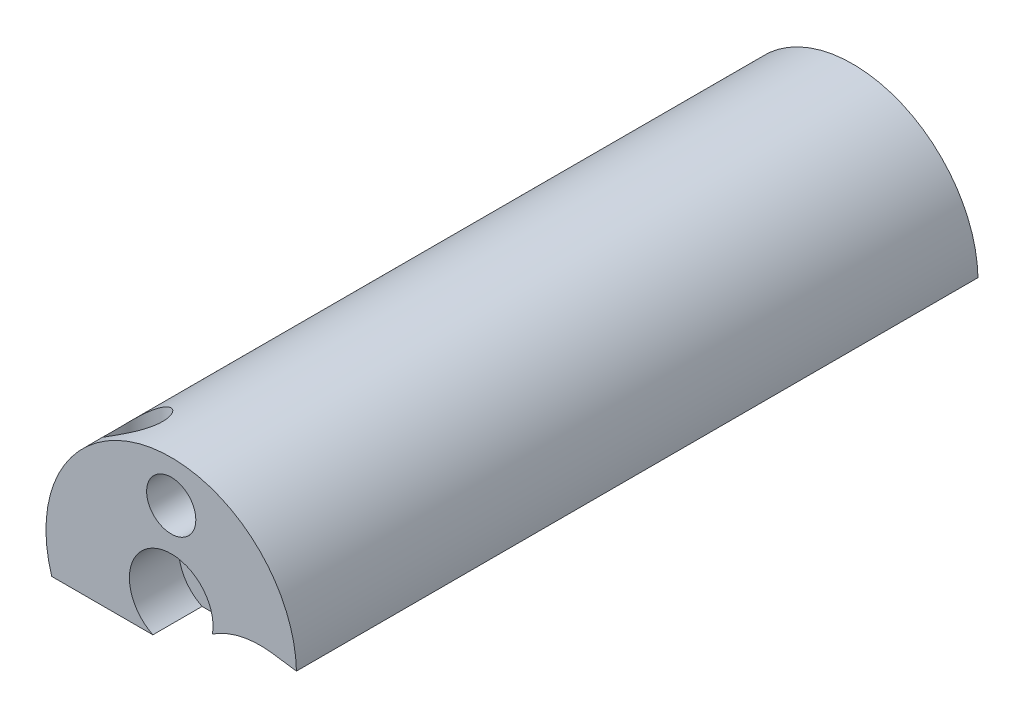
SolidWorks part; units mm, degrees
ref_plane "Face" through (0, 0, 0) normal (0, 0, 1) x (1, 0, 0)
ref_plane "Dessus" through (0, 0, 0) normal (0, 1, 0) x (1, 0, 0)
ref_plane "Droite" through (0, 0, 0) normal (1, 0, 0) x (0, 0, -1)
sketch "Esquisse1" plane through (0, 0, 0) normal (0, 0, 1) x (1, 0, 0)
  line L2 (-9.7467, -5.3471) -> (-4.9262, -5.3471)
  line L3 (-0.7787, -3.5686) -> (0.2024, -3.7065)
  line L4 (-9.7467, -5.3471) -> (-4.9262, -5.3471)
  line L5 (-0.7787, -3.5686) -> (0.2024, -3.7065)
  arc A3 (-4.9262, -5.3471) -> (-4.1148, -4.9442) centre (-4.9262, -4.3286) ccw
  arc A4 (-0.7787, -3.5686) -> (-4.1148, -4.9442) centre (-1.2748, -7.0987) ccw
  arc A5 (0.2024, -3.7065) -> (-9.7467, -5.3471) centre (-4.8888, -3.8194) ccw
  arc A6 (-4.9262, -5.3471) -> (-4.1148, -4.9442) centre (-4.9262, -4.3286) ccw
  arc A7 (-0.7787, -3.5686) -> (-4.1148, -4.9442) centre (-1.2748, -7.0987) ccw
  arc A8 (0.2024, -3.7065) -> (-9.7467, -5.3471) centre (-4.8888, -3.8194) ccw
  dimension "D1" = 0
extrude "Extrusion1" add sketch "Esquisse1" against normal up to surface (27.7093 mm away)
other "Empreinte1"
other "Elément Rabourdin 628-1,5-100 du centre<1>@jeu blocs empreintes droit_Etudiant_Corrigé"
sketch "Esquisse3" plane through (0, 0, 0) normal (0, 0, 1) x (1, 0, 0)
  circle A7 centre (-4.8888, -3.8194) radius 1.7
  circle A8 centre (-4.8888, -3.8194) radius 1.7
  dimension "D1" = 0.2
extrude "Lamage pour tête" cut sketch "Esquisse3" against normal up to surface (2 mm away)
sketch "Esquisse4" plane through (0, 0, 0) normal (0, 0, 1) x (1, 0, 0)
  circle A0 centre (-4.8888, -0.4231) radius 1
  circle A1 centre (-4.8888, -0.4231) radius 1 construction
extrude "Passage ejecteur de 2" cut sketch "Esquisse4" against normal through all
ref_plane "Plan // dessus" through (0, 3, 0) normal (0, 1, 0) x (-1, 0, 0)
sketch "Esquisse5" plane through (0, 3, 0) normal (0, 1, 0) x (-1, 0, 0)
  circle A1 centre (7.6388, -1.4) radius 1
  circle A2 centre (7.6388, -1.4) radius 1
  dimension "D1" = 0
extrude "Alésage pour goupille" cut sketch "Esquisse5" against normal through all
